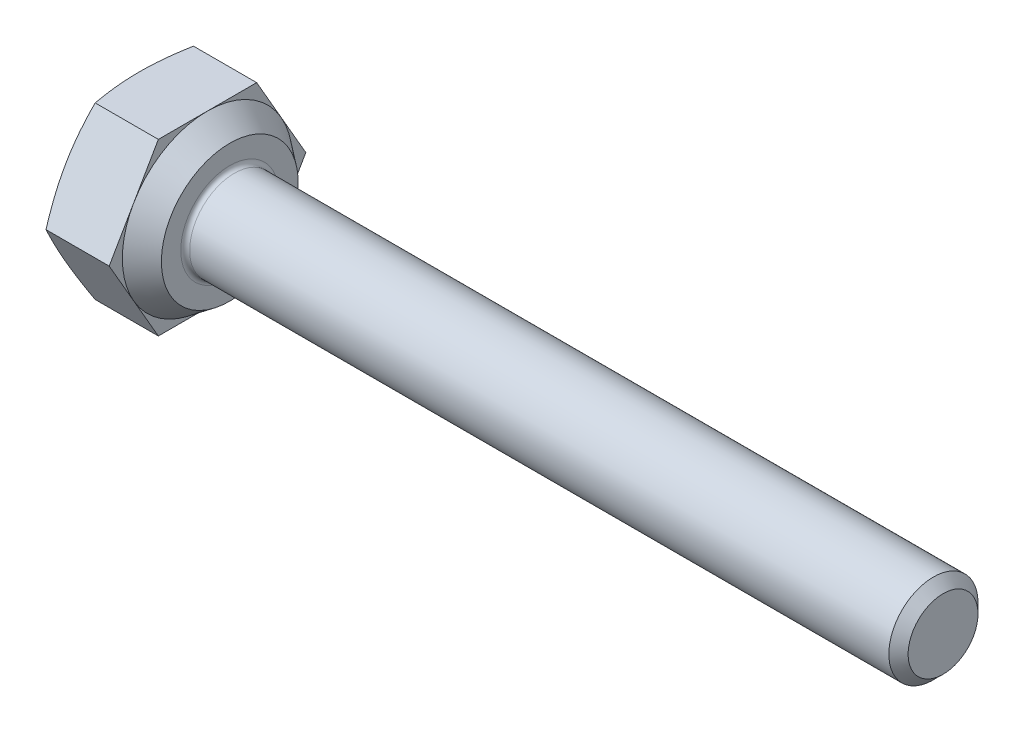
SolidWorks part; units mm, degrees
ref_plane "Front" through (0, 0, 0) normal (0, 0, 1) x (1, 0, 0)
ref_plane "Top" through (0, 0, 0) normal (0, 1, 0) x (1, 0, 0)
ref_plane "Right" through (0, 0, 0) normal (1, 0, 0) x (0, 0, -1)
sketch "Sketch-BaseHead" plane through (0, 0, 0) normal (1, 0, 0) x (0, 0, -1)
  line L1 (2.2055, 0) -> (1.1027, 1.91)
  line L2 (1.1027, 1.91) -> (-1.1027, 1.91)
  line L3 (-1.1027, 1.91) -> (-2.2055, 0)
  line L4 (-2.2055, 0) -> (-1.1027, -1.91)
  line L5 (-1.1027, -1.91) -> (1.1027, -1.91)
  line L6 (1.1027, -1.91) -> (2.2055, 0)
  circle A0 centre (0, 0) radius 1.91 construction
  dimension "s" = 3.82
extrude "BaseHead" add sketch "Sketch-BaseHead" along normal blind 1.525
sketch "Sketch4" plane through (-0.2646, 0, 5.9169) normal (0, 1, 0) x (0, 0, -1)
  line L0 (5.9169, 3.7369) -> (5.9169, -10.4477) construction
  line L2 (8.1224, -0.2646) -> (7.8269, -0.2646)
  line L4 (7.8269, -0.2646) -> (8.1224, -0.3722)
  line L6 (8.1224, -0.3722) -> (8.1224, -0.2646)
  dimension "D1" = 20
  dimension "D2" = 3.82
revolve "HeadChamfer" cut sketch "Sketch4" angle 360 about L0
sketch "Sketch1" plane through (0, 0, 0) normal (0, 0, 1) x (1, 0, 0)
  line L0 (1.525, 0) -> (2.025, 0)
  line L1 (2.025, 0) -> (2.025, -1.535)
  line L2 (2.025, -1.535) -> (1.525, -1.91)
  line L3 (1.525, -1.91) -> (1.525, 0) construction
  line L4 (0, 0) -> (7.5821, 0) construction
  line L5 (-4.0016, 0) -> (10.1831, 0) construction
  line L6 (1.525, -1.91) -> (0.1075, -1.91) construction
  line L7 (1.525, 0) -> (1.525, -1.91)
  dimension "D1" = 1.91
  dimension "c" = 0.5
  dimension "D2" = 1.535
revolve "Revolve1" add sketch "Sketch1" angle 360 about axis through (-4.0016, 0, 0) along (1, 0, 0)
ref_plane "Plane2" through (8.025, 0, 0) normal (1, 0, 0) x (0, 0, -1)
sketch "Sketch3" plane through (2.025, 0, 0) normal (1, 0, 0) x (0, 0, -1)
  circle A0 centre (0, 0) radius 1
  dimension "d" = 2
extrude "BaseBody" add sketch "Sketch3" along normal blind 16
fillet "HeadFillet" radius 0.1 1 edges at (2.025, 0, -1)
chamfer "Chamfer1" distance 0.2165 angle 45 1 edges at (18.025, 0, -1)
equation "\"D1@Sketch1\" = \"s@Sketch-BaseHead\"/ 2"
equation "\"D2@Sketch4\" = \"s@Sketch-BaseHead\""
equation "\"D1@Chamfer1\" =  ( \"d@Sketch3\" - \"D2@ThreadCosmetic1\" ) / 2 "
equation "\"b@ThreadCosmetic1\" = \"l@BaseBody\" - \"lg@Plane2\""
